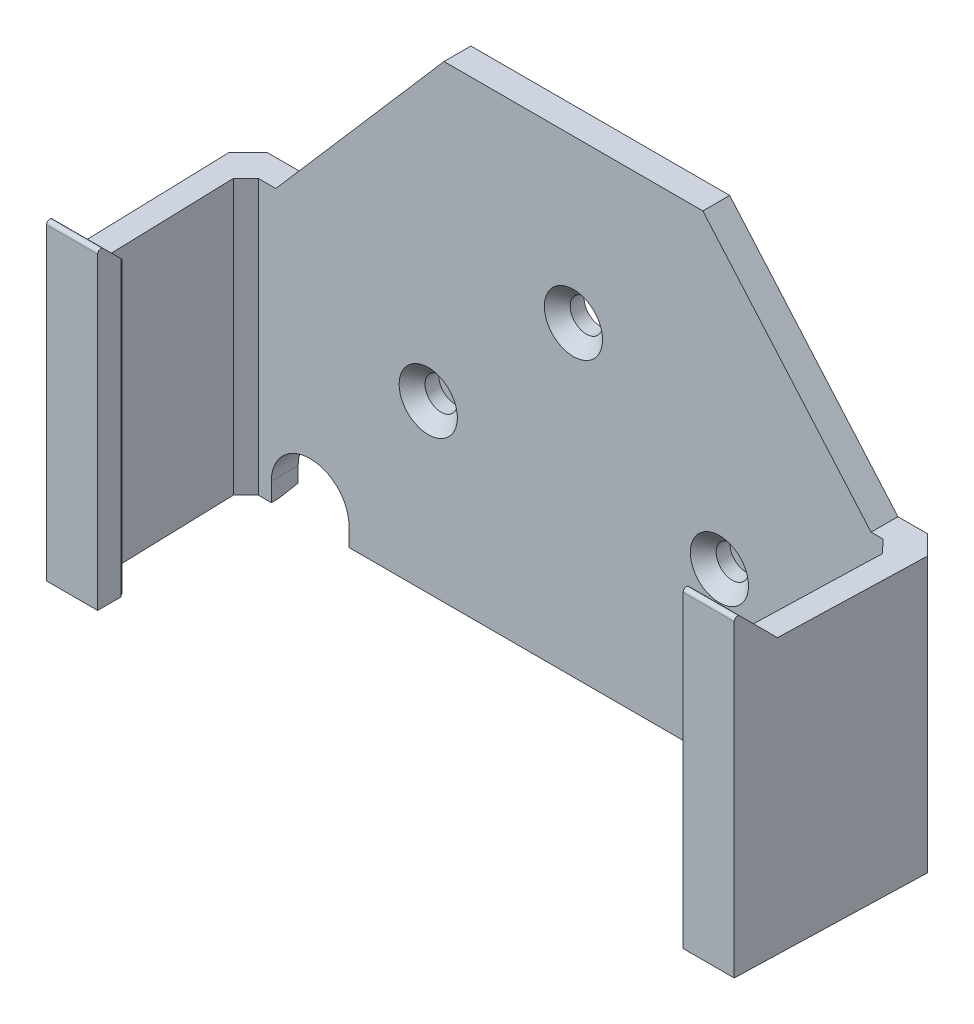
SolidWorks part; units mm, degrees
ref_plane "Ön Düzlem" through (0, 0, 0) normal (0, 0, 1) x (1, 0, 0)
ref_plane "Üst Düzlem" through (0, 0, 0) normal (0, 1, 0) x (1, 0, 0)
ref_plane "Sağ Düzlem" through (0, 0, 0) normal (1, 0, 0) x (0, 0, -1)
sketch "Çizim1" plane through (0, 0, 0) normal (0, 0, 1) x (1, 0, 0)
  line L1 (0, 0) -> (108, 0)
  line L2 (0, 0) -> (0, 48)
  line L4 (108, 0) -> (108, 48)
  line L6 (54, 74) -> (54, 0) construction
  line L9 (0, 48) -> (108, 48)
  dimension "D1" = 108
  dimension "D2" = 48
extrude "Yükseklik-Ekstrüzyon1" add sketch "Çizim1" along normal blind 32
sketch "Çizim2" plane through (0, 48, 0) normal (0, 1, 0) x (1, 0, 0)
  line L0 (8.75, -32) -> (99.25, -32)
  line L1 (3.75, -4.1499) -> (4.45, -27.6999)
  line L2 (8.75, -32) -> (8.75, -28.4256)
  line L3 (8.25, -27.6999) -> (4.45, -27.6999)
  line L6 (54, 0) -> (54, -32) construction
  line L7 (108, 0) -> (0, 0) construction
  line L8 (108, -32) -> (0, -32) construction
  line L10 (8.25, -27.6999) -> (8.75, -28.4256)
  line L11 (104.25, -4.1499) -> (3.75, -4.1499)
  line L14 (99.25, -32) -> (99.25, -28.4256)
  line L15 (99.75, -27.6999) -> (99.25, -28.4256)
  line L16 (99.75, -27.6999) -> (103.55, -27.6999)
  line L17 (104.25, -4.1499) -> (103.55, -27.6999)
  point P15 (54, -4.1499)
  point P19 (54, -4.1499)
  dimension "D1" = 50.25
  dimension "D2" = 49.55
  dimension "D3" = 23.55
  dimension "D4" = 4.3
  dimension "D5" = 0.5
extrude "Kes-Ekstrüzyon1" cut sketch "Çizim2" against normal blind 119 contours L15 L14 L0 L2 L10 L3 L1 L11 L17 L16
chamfer "Pah1" distance 3 angle 45 2 edges at (108, 24, 0) (0, 24, 0)
sketch "Çizim4" plane through (0, 0, 0) normal (-1, 0, 0) x (0, 0, 1)
  line L0 (32, 48) -> (25.5, 41.5)
  line L1 (25.5, 41.5) -> (0, 41.5)
  line L2 (0, 0) -> (0, 48) construction
  line L3 (0, 41.5) -> (0, 48)
  line L4 (0, 48) -> (32, 48)
  dimension "D1" = 6.5
  dimension "D2" = 6.5
extrude "Kes-Ekstrüzyon2" cut sketch "Çizim4" against normal blind 116
fillet "Radyus2" radius 0.5 2 edges at (103.625, 48, 32) (4.375, 48, 32)
sketch "Çizim6" plane through (0, 41.5, 0) normal (0, 1, 0) x (1, 0, 0)
  line L0 (0, -3) -> (0.862, -32)
  line L1 (8.75, -32) -> (0, -32) construction
  line L2 (0.862, -32) -> (-3.7056, -32)
  line L3 (-3.7056, -32) -> (0, -3)
  line L4 (3.75, -4.1499) -> (4.3846, -25.5) construction
  line L5 (54, 0) -> (54, -36) construction
  line L6 (105, 0) -> (3, 0) construction
  line L7 (111.7056, -32) -> (108, -3)
  line L8 (107.138, -32) -> (111.7056, -32)
  line L9 (108, -3) -> (107.138, -32)
extrude "Kes-Ekstrüzyon4" cut sketch "Çizim6" against normal mid plane 100
sketch "Çizim7" plane through (0, 0, 0) normal (0, 0, -1) x (-1, 0, 0)
  line L0 (-94.75, 8) -> (-83.0882, 8) construction
  line L1 (-3, 0) -> (-105, 0) construction
  line L2 (-88.75, 2) -> (-88.75, -3.4773) construction
  line L3 (-94.75, 2) -> (-13.75, 2) construction
  line L6 (-100.75, 2) -> (-100.75, 0)
  line L7 (-88.75, 2) -> (-88.75, 0)
  line L8 (-88.75, 0) -> (-100.75, 0)
  line L9 (-104.25, 41.5) -> (-104.25, 0) construction
  line L10 (-19.75, 2) -> (-19.75, 0)
  line L11 (-19.75, 0) -> (-7.75, 0)
  line L12 (-7.75, 2) -> (-7.75, 0)
  line L16 (-4.45, 43.6999) -> (-4.45, 0) construction
  line L19 (-105, 41.5) -> (-3, 41.5) construction
  line L20 (-108, 0) -> (-108, 41.5) construction
  arc A0 (-88.75, 2) -> (-100.75, 2) centre (-94.75, 2) ccw
  arc A1 (-19.75, 2) -> (-7.75, 2) centre (-13.75, 2) cw
  dimension "D1" = 12
  dimension "D2" = 3.75
  dimension "D3" = 8
  dimension "D4" = 93
  dimension "D5" = 3.5
extrude "Kes-Ekstrüzyon5" cut sketch "Çizim7" against normal blind 4.25
sketch "Çizim8" plane through (0, 0, 0) normal (0, 0, -1) x (-1, 0, 0)
  line L0 (-105, 41.5) -> (-105, 0) construction
  circle A0 centre (-77, 24.8351) radius 2.5
  circle A1 centre (-32, 24.8351) radius 2.5
  dimension "D1" = 5
  dimension "D2" = 5
  dimension "D3" = 45
  dimension "D4" = 28
extrude "Kes-Ekstrüzyon6" cut sketch "Çizim8" against normal blind 10
chamfer "Pah2" distance 2 angle 45 2 edges at (74.5, 24.8351, 4.1499) (29.5, 24.8351, 4.1499)
fillet "Radyus4" radius 0.2 2 edges at (103.55, 21.8499, 27.6999) (4.45, 21.8499, 27.6999)
sketch "Çizim9" plane through (0, 0, 0) normal (0, -1, 0) x (1, 0, 0)
  line L0 (0.862, 32) -> (0, 3)
  line L1 (0, 3) -> (3, 0)
  line L2 (3, 0) -> (7.75, 0)
  line L3 (7.75, 0) -> (7.75, 4.1499)
  line L4 (7.75, 4.1499) -> (4.2651, 4.1499)
  line L5 (0.862, 32) -> (8.75, 32)
  line L6 (8.75, 32) -> (8.75, 28.4256)
  line L7 (8.75, 28.4256) -> (8.25, 27.6999)
  line L8 (8.25, 27.6999) -> (4.6441, 27.6999)
  line L9 (4.4442, 27.5058) -> (3.7653, 4.6648)
  line L10 (54.25, 4.1499) -> (54.25, 37.1199) construction
  line L11 (19.75, 0) -> (88.75, 0) construction
  line L12 (19.75, 4.1499) -> (19.75, 0)
  line L13 (19.75, 0) -> (54.25, 0)
  line L15 (88.75, 4.1499) -> (19.75, 4.1499) construction
  line L16 (54.25, 4.1499) -> (19.75, 4.1499)
  line L17 (100.75, 4.1499) -> (100.75, 0)
  line L18 (100.75, 0) -> (105, 0)
  line L19 (105, 0) -> (108, 3)
  line L20 (108, 3) -> (107.138, 32)
  line L21 (107.138, 32) -> (99.25, 32)
  line L22 (99.25, 32) -> (99.25, 28.4256)
  line L23 (99.25, 28.4256) -> (99.75, 27.6999)
  line L24 (99.75, 27.6999) -> (103.3559, 27.6999)
  line L25 (100.75, 4.1499) -> (103.7349, 4.1499)
  line L26 (104.2347, 4.6648) -> (103.5558, 27.5058)
  line L27 (54.25, 4.1499) -> (88.75, 4.1499)
  line L28 (88.75, 4.1499) -> (88.75, 0)
  line L29 (88.75, 0) -> (54.25, 0)
  line L30 (54.25, 4.1499) -> (88.75, 4.1499)
  line L31 (4.2651, 4.1499) -> (3.75, 4.1499)
  line L32 (3.75, 4.1499) -> (3.7653, 4.6648)
  line L33 (103.7349, 4.1499) -> (104.25, 4.1499)
  line L34 (104.25, 4.1499) -> (104.2347, 4.6648)
  arc A0 (4.6441, 27.6999) -> (4.4442, 27.5058) centre (4.6441, 27.4999) ccw
  arc A3 (103.3559, 27.6999) -> (103.5558, 27.5058) centre (103.3559, 27.4999) cw
extrude "Yükseklik-Ekstrüzyon2" add sketch "Çizim9" along normal blind 9
chamfer "Pah3" distance 2 angle 45 2 edges at (104.25, 16.25, 4.1499) (3.75, 16.25, 4.1499)
sketch "Çizim10" plane through (0, 0, 0) normal (0, 0, -1) x (-1, 0, 0)
  line L0 (-100.4406, 41.5) -> (-74.4406, 71.5)
  line L1 (-105, 41.5) -> (-3, 41.5) construction
  line L2 (-74.4406, 71.5) -> (-34.4406, 71.5)
  line L3 (-34.4406, 71.5) -> (-8.4406, 41.5)
  line L4 (-8.4406, 41.5) -> (-100.4406, 41.5)
  line L5 (-54.4406, 41.5) -> (-54.4406, 80.707) construction
  point P9 (-54.4406, 71.5)
  dimension "D1" = 92
  dimension "D2" = 3.75
  dimension "D3" = 40
  dimension "D4" = 30
extrude "Yükseklik-Ekstrüzyon3" add sketch "Çizim10" against normal up to surface (4.1499 mm away)
sketch "Çizim11" plane through (0, 0, 4.1499) normal (0, 0, 1) x (1, 0, 0)
  line L0 (54.4406, 71.5) -> (54.4406, 46.5) construction
  line L1 (74.4406, 71.5) -> (34.4406, 71.5) construction
  circle A0 centre (54.4406, 46.5) radius 2.5
  dimension "D1" = 5
  dimension "D2" = 25
extrude "Kes-Ekstrüzyon7" cut sketch "Çizim11" against normal blind 9
chamfer "Pah4" distance 2 angle 45 1 edges at (56.9406, 46.5, 4.1499)
sketch "Çizim12" plane through (0, 0, 0) normal (0, 0, -1) x (-1, 0, 0)
  line L1 (-84.4406, -9) -> (-84.4406, 56.0555)
  line L5 (-19.75, -9) -> (-88.75, -9) construction
  line L7 (-24.4406, 56.0555) -> (-24.4406, -9)
  line L8 (-24.4406, -9) -> (-44.4406, -9)
  line L9 (-54.4406, 71.5) -> (-54.4406, -12.71) construction
  line L10 (-34.4406, 71.5) -> (-74.4406, 71.5) construction
  line L11 (-64.4406, 56.0555) -> (-64.4406, -9)
  line L12 (-44.4406, 56.0555) -> (-44.4406, -9)
  line L18 (-64.4406, -9) -> (-84.4406, -9)
  line L19 (-84.4406, 56.0555) -> (-64.4406, 56.0555)
  line L20 (-44.4406, 56.0555) -> (-24.4406, 56.0555)
  dimension "D2" = 20
  dimension "D3" = 20
extrude "Yükseklik-Ekstrüzyon4" add sketch "Çizim12" along normal blind 25 contours L18 L1 L19 L11 | L7 L8 L12 L20
fillet "Radyus5" radius 1 4 edges at (24.4406, 23.5278, 0) (84.4406, 23.5278, 0) (64.4406, 23.5278, 0) (44.4406, 23.5278, 0)
sketch "Çizim13" plane through (0, -9, 0) normal (0, -1, 0) x (1, 0, 0)
  line L12 (88.75, 0) -> (88.75, 4.1499)
  line L13 (88.75, 4.1499) -> (19.75, 4.1499)
  line L14 (19.75, 4.1499) -> (19.75, 0)
  line L15 (19.75, 0) -> (23.4406, 0)
  line L16 (24.4406, -1) -> (24.4406, -25)
  line L17 (24.4406, -25) -> (44.4406, -25)
  line L18 (44.4406, -25) -> (44.4406, -1)
  line L19 (45.4406, 0) -> (63.4406, 0)
  line L20 (64.4406, -1) -> (64.4406, -25)
  line L21 (64.4406, -25) -> (84.4406, -25)
  line L22 (84.4406, -25) -> (84.4406, -1)
  line L23 (85.4406, 0) -> (88.75, 0)
  line L24 (88.75, 0) -> (88.75, 4.1499)
  line L25 (88.75, 4.1499) -> (19.75, 4.1499)
  line L26 (19.75, 4.1499) -> (19.75, 0)
  line L27 (19.75, 0) -> (23.4406, 0)
  line L28 (24.4406, -1) -> (24.4406, -25)
  line L29 (24.4406, -25) -> (44.4406, -25)
  line L30 (44.4406, -25) -> (44.4406, -1)
  line L31 (45.4406, 0) -> (63.4406, 0)
  line L32 (64.4406, -1) -> (64.4406, -25)
  line L33 (64.4406, -25) -> (84.4406, -25)
  line L34 (84.4406, -25) -> (84.4406, -1)
  line L35 (85.4406, 0) -> (88.75, 0)
  line L46 (4.6441, 27.6999) -> (8.25, 27.6999)
  line L47 (8.25, 27.6999) -> (8.75, 28.4256)
  line L48 (8.75, 28.4256) -> (8.75, 32)
  line L49 (8.75, 32) -> (0.862, 32)
  line L50 (0.862, 32) -> (0, 3)
  line L51 (0, 3) -> (3, 0)
  line L52 (3, 0) -> (7.75, 0)
  line L53 (7.75, 0) -> (7.75, 4.1499)
  line L54 (7.75, 4.1499) -> (5.75, 4.1499)
  line L55 (5.75, 4.1499) -> (3.8077, 6.0922)
  line L56 (3.8077, 6.0922) -> (4.4442, 27.5058)
  line L57 (4.6441, 27.6999) -> (8.25, 27.6999)
  line L58 (8.25, 27.6999) -> (8.75, 28.4256)
  line L59 (8.75, 28.4256) -> (8.75, 32)
  line L60 (8.75, 32) -> (0.862, 32)
  line L61 (0.862, 32) -> (0, 3)
  line L62 (0, 3) -> (3, 0)
  line L63 (3, 0) -> (7.75, 0)
  line L64 (7.75, 0) -> (7.75, 4.1499)
  line L65 (7.75, 4.1499) -> (5.75, 4.1499)
  line L66 (5.75, 4.1499) -> (3.8077, 6.0922)
  line L67 (3.8077, 6.0922) -> (4.4442, 27.5058)
  line L68 (99.75, 27.6999) -> (103.3559, 27.6999)
  line L69 (103.5558, 27.5058) -> (104.1906, 6.149)
  line L70 (104.1906, 6.149) -> (102.3069, 4.1499)
  line L71 (102.3069, 4.1499) -> (100.75, 4.1499)
  line L72 (100.75, 4.1499) -> (100.75, 0)
  line L73 (100.75, 0) -> (105, 0)
  line L74 (105, 0) -> (108, 3)
  line L75 (108, 3) -> (107.138, 32)
  line L76 (107.138, 32) -> (99.25, 32)
  line L77 (99.25, 32) -> (99.25, 28.4256)
  line L78 (99.25, 28.4256) -> (99.75, 27.6999)
  line L79 (99.75, 27.6999) -> (103.3559, 27.6999)
  line L80 (103.5558, 27.5058) -> (104.1906, 6.149)
  line L81 (104.1906, 6.149) -> (102.3069, 4.1499)
  line L82 (102.3069, 4.1499) -> (100.75, 4.1499)
  line L83 (100.75, 4.1499) -> (100.75, 0)
  line L84 (100.75, 0) -> (105, 0)
  line L85 (105, 0) -> (108, 3)
  line L86 (108, 3) -> (107.138, 32)
  line L87 (107.138, 32) -> (99.25, 32)
  line L88 (99.25, 32) -> (99.25, 28.4256)
  line L89 (99.25, 28.4256) -> (99.75, 27.6999)
  arc A2 (4.6441, 27.6999) -> (4.4442, 27.5058) centre (4.6441, 27.4999) ccw
  arc A3 (4.6441, 27.6999) -> (4.4442, 27.5058) centre (4.6441, 27.4999) ccw
  arc A4 (24.4406, -1) -> (23.4406, 0) centre (23.4406, -1) ccw
  arc A5 (45.4406, 0) -> (44.4406, -1) centre (45.4406, -1) ccw
  arc A6 (64.4406, -1) -> (63.4406, 0) centre (63.4406, -1) ccw
  arc A7 (85.4406, 0) -> (84.4406, -1) centre (85.4406, -1) ccw
  arc A8 (24.4406, -1) -> (23.4406, 0) centre (23.4406, -1) ccw
  arc A9 (45.4406, 0) -> (44.4406, -1) centre (45.4406, -1) ccw
  arc A10 (64.4406, -1) -> (63.4406, 0) centre (63.4406, -1) ccw
  arc A11 (85.4406, 0) -> (84.4406, -1) centre (85.4406, -1) ccw
  arc A12 (103.5558, 27.5058) -> (103.3559, 27.6999) centre (103.3559, 27.4999) ccw
  arc A13 (103.5558, 27.5058) -> (103.3559, 27.6999) centre (103.3559, 27.4999) ccw
  dimension "D1" = 0
  dimension "D2" = 0
  dimension "D3" = 0
extrude "Yükseklik-Ekstrüzyon6" add sketch "Çizim13" along normal blind 6
sketch "Çizim14" plane through (84.4406, 0, 0) normal (1, 0, 0) x (0, 0, -1)
  line L0 (25, -15) -> (0, 56.0555)
  line L1 (0, 56.0555) -> (25, 56.0555)
  line L2 (25, 56.0555) -> (25, -15)
extrude "Kes-Ekstrüzyon10" cut sketch "Çizim14" against normal mid plane 189
sketch "Çizim15" plane through (84.4406, 0, 0) normal (1, 0, 0) x (0, 0, -1)
  line L0 (-32, -15) -> (23.0649, -9.5)
  line L1 (1, 53.2133) -> (25, -15) construction
  line L2 (23.0649, -9.5) -> (25, -15)
  line L3 (25, -15) -> (-32, -15)
  point P5 (-31.5772, -14.9596)
  dimension "D1" = 5.5
extrude "Kes-Ekstrüzyon11" cut sketch "Çizim15" against normal mid plane 189
sketch "Çizim16" plane through (-0.0891, 0, 0.0026) normal (-0.9996, 0, 0.0297) x (0.0297, 0, 0.9996)
  line L0 (25.5086, 41.5) -> (25.5086, -0.9) construction
  line L1 (2.9987, -0.9) -> (0.0891, -0.9)
  line L2 (2.9987, -0.9) -> (52.0112, -0.9)
  line L3 (2.9987, 41.5) -> (2.9987, -12.1034) construction
  line L5 (0.0891, -0.9) -> (0.0891, -15.3765)
  line L6 (0.0891, -15.3765) -> (43.6064, -19.919)
  line L7 (52.0112, -0.9) -> (43.6064, -19.919)
  line L8 (0.0891, -11.8038) -> (0.0891, 41.5) construction
  dimension "D1" = 42.4
extrude "Kes-Ekstrüzyon12" cut sketch "Çizim16" against normal mid plane 379
sketch "Çizim18" plane through (84.4406, 0, 0) normal (1, 0, 0) x (0, 0, -1)
  line L1 (1, 53.2133) -> (23.0649, -9.5) construction
  line L2 (0, -0.9) -> (21.544, -0.9) construction
  line L3 (18.6317, 3.1) -> (31.0096, -13.9009)
  line L4 (31.0096, -13.9009) -> (-2.7193, -12.2834)
  line L7 (-3, -0.9) -> (18.6317, 3.1)
  line L8 (-3, -0.9) -> (-2.7193, -12.2834)
  dimension "D1" = 4
extrude "Kes-Ekstrüzyon13" cut sketch "Çizim18" against normal mid plane 379
